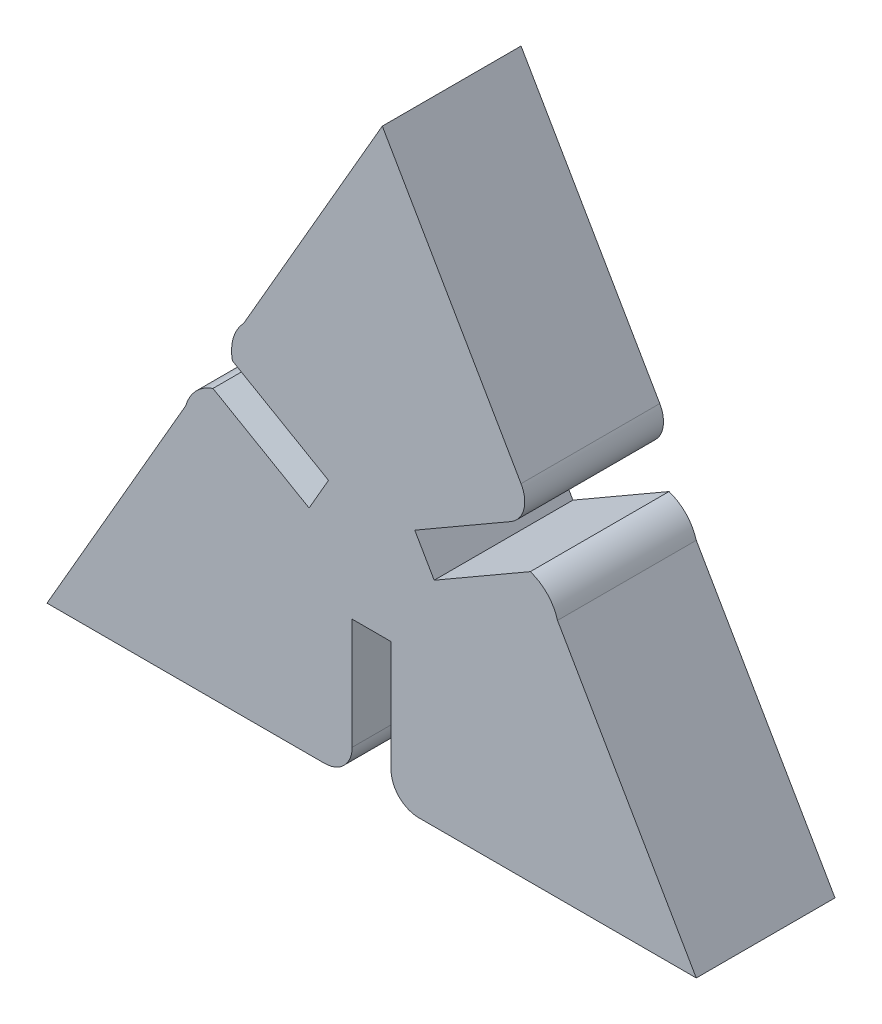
SolidWorks part; units mm, degrees
ref_plane "Front Plane" through (0, 0, 0) normal (0, 0, 1) x (1, 0, 0)
ref_plane "Top Plane" through (0, 0, 0) normal (0, 1, 0) x (1, 0, 0)
ref_plane "Right Plane" through (0, 0, 0) normal (1, 0, 0) x (0, 0, -1)
sketch "Sketch1" plane through (0, 0, 0) normal (0, 0, 1) x (1, 0, 0)
  line L0 (-13.4, -9.545) -> (-23.4, -26.8656)
  line L1 (-4.5091, -11.4804) -> (-3.1091, -9.0555)
  line L2 (-23.4, -26.8656) -> (-3.4, -26.8656)
  line L3 (-1.4, -16.8656) -> (1.4, -16.8656)
  line L4 (-3.8091, -10.268) -> (-13.2401, -4.823) construction
  line L5 (0, -16.5482) -> (0, -36.0463) construction
  line L6 (3.5343, -10.4266) -> (20.4201, -0.6776) construction
  line L7 (3.1091, -9.0555) -> (10.0373, -5.0555)
  line L8 (-3.1091, -9.0555) -> (-10.0373, -5.0555)
  line L9 (-4.5091, -11.4804) -> (-11.4373, -7.4804)
  line L11 (0.7694, 14.997) -> (10.7694, -2.3235)
  line L12 (-9.2306, -2.3235) -> (0.7694, 14.997)
  line L13 (1.4, -16.8656) -> (1.4, -24.8656)
  line L14 (-1.4, -16.8656) -> (-1.4, -24.8656)
  line L15 (4.5091, -11.4804) -> (11.4373, -7.4804)
  line L16 (23.4, -26.8656) -> (3.4, -26.8656)
  line L17 (4.5091, -11.4804) -> (3.1091, -9.0555)
  line L18 (13.4, -9.545) -> (23.4, -26.8656)
  line L19 (-1.4, -12.6235) -> (-1.4, -36.0463) construction
  line L21 (0, -12.6235) -> (0, -36.0463) construction
  arc A0 (-13.4, -9.545) -> (-11.4373, -7.4804) centre (-10.4651, -10.3698) cw
  arc A1 (10.0373, -5.0555) -> (10.7694, -2.3235) centre (9.0373, -3.3235) ccw
  arc A2 (-9.2306, -2.3235) -> (-10.0373, -5.0555) centre (-7.0489, -4.4528) ccw
  arc A3 (1.4, -24.8656) -> (3.4, -26.8656) centre (3.4, -24.8656) ccw
  arc A4 (-1.4, -24.8656) -> (-3.4, -26.8656) centre (-3.4, -24.8656) cw
  arc A5 (13.4, -9.545) -> (11.4373, -7.4804) centre (10.4651, -10.3698) ccw
  point P0 (0, 16.4357)
  point P1 (-35.5296, -0.3486)
  point P2 (0, -3.5643)
  point P3 (25, -26.8656)
  point P5 (3.3885, -19.8077)
  point P6 (2.6937, -16.7666)
  point P7 (30.5221, -2.8524)
  point P11 (-7.6795, -16.8656)
  point P12 (7.6795, -16.8656)
  point P13 (10, -12.6235)
  point P14 (10, -36.0463)
  point P15 (-36.1557, -1.6008)
  point P17 (2.7624, -21.0599)
  point P20 (3.3198, -18.0188)
  point P21 (31.1482, -4.1046)
  point P53 (0, -16.8656)
  point P54 (0, -16.8656)
extrude "Boss-Extrude3" add sketch "Sketch1" along normal blind 10
equation "\"A\"=8"
equation "\"D3@Sketch1\"= \"A\""
equation "\"B\"= \"A\" * 7 / 40"
equation "\"D2@Sketch1\"=\"B\""
equation "\"D4@Sketch1\" = \"A\" * 2.5"
equation "\"D5@Sketch1\" = \"A\" * 2.5"
